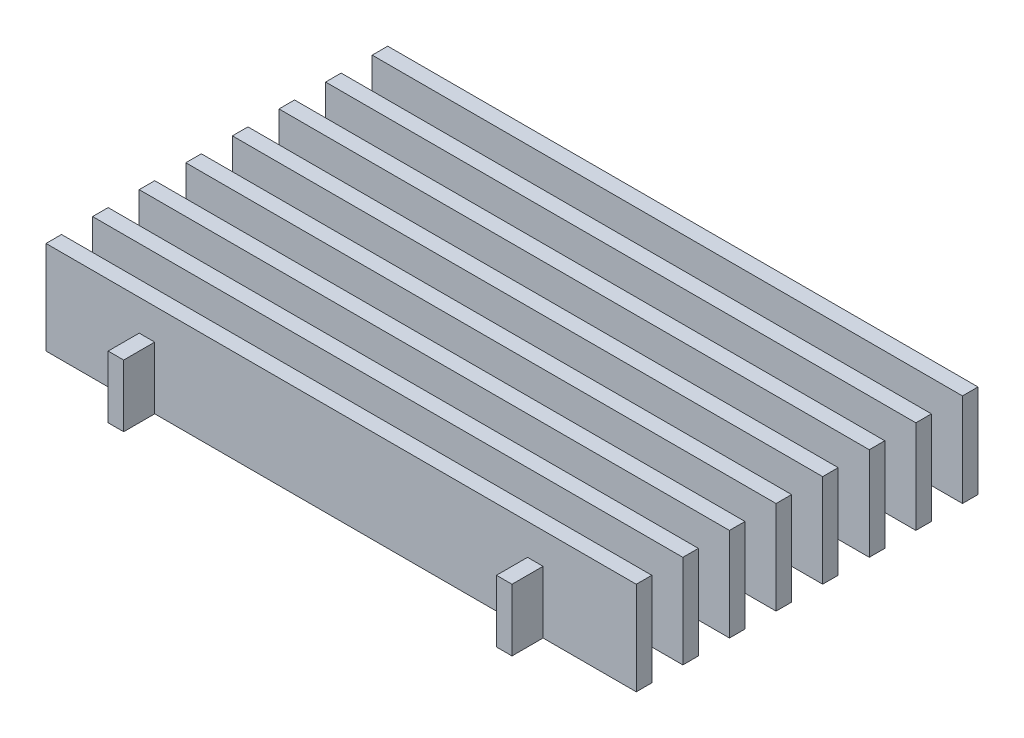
SolidWorks part; units mm, degrees
ref_plane "Front Plane" through (0, 0, 0) normal (0, 0, 1) x (1, 0, 0)
ref_plane "Top Plane" through (0, 0, 0) normal (0, 1, 0) x (1, 0, 0)
ref_plane "Right Plane" through (0, 0, 0) normal (1, 0, 0) x (0, 0, -1)
sketch "Sketch2" plane through (0, 0, 0) normal (0, 1, 0) x (1, 0, 0)
  line L0 (-60.325, -22.225) -> (60.325, -25.4) construction
  line L1 (-60.325, -31.75) -> (60.325, -31.75)
  line L2 (-60.325, -31.75) -> (-60.325, -34.925)
  line L3 (-60.325, -34.925) -> (60.325, -34.925)
  line L4 (60.325, -31.75) -> (60.325, -34.925)
  line L5 (-60.325, -31.75) -> (60.325, -34.925) construction
  line L6 (-60.325, -34.925) -> (60.325, -31.75) construction
  line L7 (-60.325, -25.4) -> (60.325, -22.225) construction
  line L8 (-60.325, -22.225) -> (-60.325, -25.4)
  line L9 (-60.325, -22.225) -> (60.325, -22.225)
  line L10 (60.325, -22.225) -> (60.325, -25.4)
  line L11 (-60.325, -25.4) -> (60.325, -25.4)
  line L12 (-60.325, -12.7) -> (60.325, -15.875) construction
  line L13 (-60.325, -15.875) -> (60.325, -12.7) construction
  line L14 (-60.325, -12.7) -> (-60.325, -15.875)
  line L15 (-60.325, -12.7) -> (60.325, -12.7)
  line L16 (60.325, -12.7) -> (60.325, -15.875)
  line L17 (-60.325, -15.875) -> (60.325, -15.875)
  line L18 (-60.325, -3.175) -> (60.325, -6.35) construction
  line L19 (-60.325, -6.35) -> (60.325, -3.175) construction
  line L20 (-60.325, -3.175) -> (-60.325, -6.35)
  line L21 (-60.325, -3.175) -> (60.325, -3.175)
  line L22 (60.325, -3.175) -> (60.325, -6.35)
  line L23 (-60.325, -6.35) -> (60.325, -6.35)
  line L24 (-60.325, 6.35) -> (60.325, 3.175) construction
  line L25 (-60.325, 3.175) -> (60.325, 6.35) construction
  line L26 (-60.325, 6.35) -> (-60.325, 3.175)
  line L27 (-60.325, 6.35) -> (60.325, 6.35)
  line L28 (60.325, 6.35) -> (60.325, 3.175)
  line L29 (-60.325, 3.175) -> (60.325, 3.175)
  line L30 (-60.325, 15.875) -> (60.325, 12.7) construction
  line L31 (-60.325, 12.7) -> (60.325, 15.875) construction
  line L32 (-60.325, 15.875) -> (-60.325, 12.7)
  line L33 (-60.325, 15.875) -> (60.325, 15.875)
  line L34 (60.325, 15.875) -> (60.325, 12.7)
  line L35 (-60.325, 12.7) -> (60.325, 12.7)
  line L36 (-60.325, 25.4) -> (60.325, 22.225) construction
  line L37 (-60.325, 22.225) -> (60.325, 25.4) construction
  line L38 (-60.325, 25.4) -> (-60.325, 22.225)
  line L39 (-60.325, 25.4) -> (60.325, 25.4)
  line L40 (60.325, 25.4) -> (60.325, 22.225)
  line L41 (-60.325, 22.225) -> (60.325, 22.225)
  line L42 (-60.325, 34.925) -> (60.325, 31.75) construction
  line L43 (-60.325, 31.75) -> (60.325, 34.925) construction
  line L44 (-60.325, 34.925) -> (-60.325, 31.75)
  line L45 (-60.325, 34.925) -> (60.325, 34.925)
  line L46 (60.325, 34.925) -> (60.325, 31.75)
  line L47 (-60.325, 31.75) -> (60.325, 31.75)
  line L48 (0, -3.175) -> (0, 3.175) construction
  point P0 (0, -33.3375)
  point P39 (0, 0)
  dimension "D2" = 3.175
  dimension "D3" = 6.35
  dimension "D4" = 120.65
  dimension "D1" = 8
extrude "Boss-Extrude1" add sketch "Sketch2" along normal mid plane 19.05
sketch "Sketch3" plane through (0, -9.525, 0) normal (0, -1, 0) x (1, 0, 0)
  line L0 (-38.1, 0) -> (38.1, 0) construction
  line L1 (-38.1, -41.275) -> (-41.275, -41.275)
  line L2 (-38.1, -41.275) -> (-38.1, 41.275)
  line L3 (-38.1, 41.275) -> (-41.275, 41.275)
  line L4 (-41.275, -41.275) -> (-41.275, 41.275)
  line L5 (-38.1, -41.275) -> (-41.275, 41.275) construction
  line L6 (-38.1, 41.275) -> (-41.275, -41.275) construction
  line L7 (41.275, -41.275) -> (38.1, -41.275)
  line L8 (41.275, -41.275) -> (41.275, 41.275)
  line L9 (41.275, 41.275) -> (38.1, 41.275)
  line L10 (38.1, -41.275) -> (38.1, 41.275)
  line L11 (41.275, -41.275) -> (38.1, 41.275) construction
  line L12 (41.275, 41.275) -> (38.1, -41.275) construction
  line L13 (-60.325, -34.925) -> (-60.325, -31.75) construction
  point P0 (-39.6875, 0)
  point P5 (39.6875, 0)
  point P14 (0, 0)
  dimension "D1" = 76.2
  dimension "D2" = 82.55
extrude "Boss-Extrude2" add sketch "Sketch3" against normal blind 12.7
sketch "Sketch4" plane through (0, -9.525, 0) normal (0, -1, 0) x (1, 0, 0)
  line L0 (41.275, -41.275) -> (41.275, -34.925) construction
  line L1 (38.1, -34.925) -> (31.75, -34.925)
  line L2 (38.1, -34.925) -> (38.1, -41.275)
  line L3 (38.1, -41.275) -> (31.75, -41.275)
  line L4 (31.75, -34.925) -> (31.75, -41.275)
  line L5 (-31.75, -34.925) -> (-31.75, -41.275)
  line L6 (0, 0) -> (-24.1959, 0) construction
  line L7 (0, 0) -> (0, -19.1592) construction
  line L10 (-38.1, -41.275) -> (-31.75, -41.275)
  line L11 (-38.1, -34.925) -> (-38.1, -41.275)
  line L12 (-38.1, -34.925) -> (-31.75, -34.925)
  line L13 (-38.1, 34.925) -> (-31.75, 34.925)
  line L14 (-38.1, 34.925) -> (-38.1, 41.275)
  line L15 (-38.1, 41.275) -> (-31.75, 41.275)
  line L16 (-31.75, 34.925) -> (-31.75, 41.275)
  line L17 (31.75, 34.925) -> (31.75, 41.275)
  line L18 (38.1, 41.275) -> (31.75, 41.275)
  line L19 (38.1, 34.925) -> (38.1, 41.275)
  line L20 (38.1, 34.925) -> (31.75, 34.925)
  circle A0 centre (34.925, -38.1) radius 1.5875
  circle A1 centre (-34.925, -38.1) radius 1.5875
  circle A2 centre (-34.925, 38.1) radius 1.5875
  circle A3 centre (34.925, 38.1) radius 1.5875
  dimension "D3" = 3.175
  dimension "D1" = 3.175
  dimension "D2" = 3.175
extrude "Boss-Extrude3" [suppressed] add sketch "Sketch4" against normal blind 3.175 separate body
